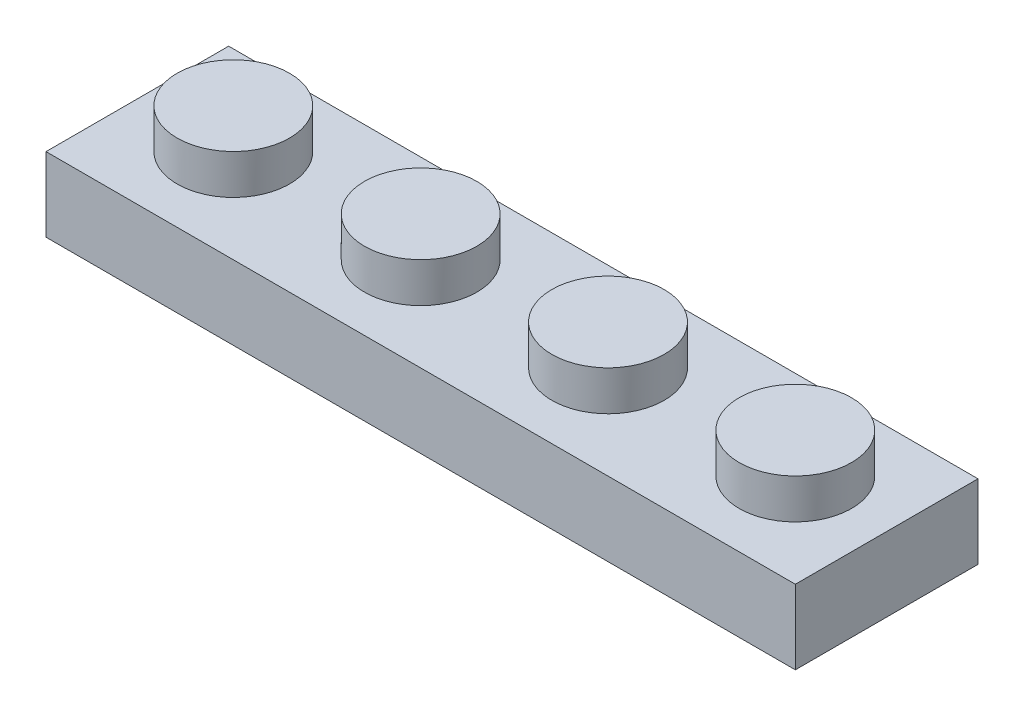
SolidWorks part; units mm, degrees
ref_plane "Front Plane" through (0, 0, 0) normal (0, 0, 1) x (1, 0, 0)
ref_plane "Top Plane" through (0, 0, 0) normal (0, 1, 0) x (1, 0, 0)
ref_plane "Right Plane" through (0, 0, 0) normal (1, 0, 0) x (0, 0, -1)
sketch "Sketch1" plane through (0, 0, 0) normal (0, 1, 0) x (1, 0, 0)
  line L1 (0, 0) -> (32, 0)
  line L2 (0, 0) -> (0, 7.8)
  line L3 (0, 7.8) -> (32, 7.8)
  line L4 (32, 0) -> (32, 7.8)
  dimension "D1" = 32
  dimension "D2" = 7.8
extrude "Extrude1" add sketch "Sketch1" along normal blind 3.166
sketch "Sketch2" plane through (0, 3.166, 0) normal (0, 1, 0) x (1, 0, 0)
  circle A0 centre (4, 4) radius 2.4
  point P6 (9.3567, 6.1688)
  dimension "D1" = 4.8
extrude "Extrude2" add sketch "Sketch2" along normal blind 1.7
sketch "Sketch3" plane through (0, 0, 0) normal (0, -1, 0) x (1, 0, 0)
  line L0 (32, 0) -> (32, -7.8) construction
  line L1 (25.75, -1.55) -> (30.55, -1.55)
  line L2 (25.75, -1.55) -> (25.75, -6.35)
  line L3 (25.75, -6.35) -> (30.55, -6.35)
  line L4 (30.55, -1.55) -> (30.55, -6.35)
  line L5 (32, -7.8) -> (0, -7.8) construction
  dimension "D1" = 4.8
  dimension "D2" = 1.45
  dimension "D3" = 1.45
extrude "Extrude3" cut sketch "Sketch3" against normal blind 1.75
sketch "Sketch4" plane through (0, 3.166, 0) normal (0, 1, 0) x (1, 0, 0)
  line L0 (0, 3.9) -> (35.7528, 3.9) construction
  line L1 (0, 7.8) -> (0, 0) construction
pattern_linear "LPattern1" count 4 spacing 8 along (1, 0, 0) of "Extrude2"
pattern_linear "LPattern2" count 4 spacing 8 along (-1, 0, 0) of "Extrude3"
